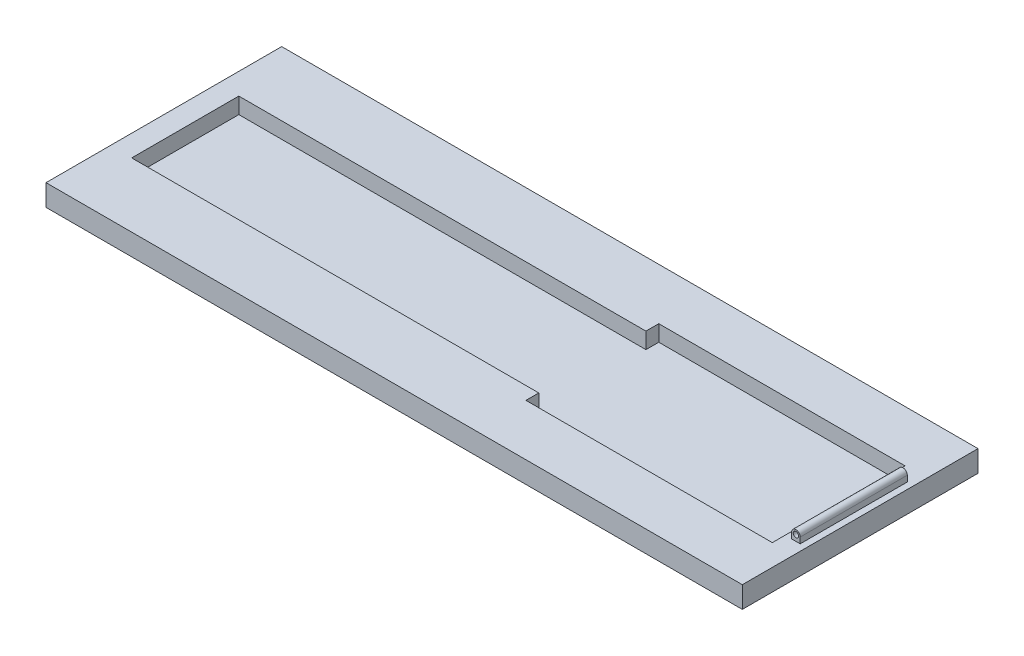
SolidWorks part; units mm, degrees
ref_plane "Face" through (0, 0, 0) normal (0, 0, 1) x (1, 0, 0)
ref_plane "Dessus" through (0, 0, 0) normal (0, 1, 0) x (1, 0, 0)
ref_plane "Droite" through (0, 0, 0) normal (1, 0, 0) x (0, 0, -1)
sketch "Esquisse1" plane through (0, 0, 0) normal (0, 0, 1) x (1, 0, 0)
  line L1 (-6400, -55) -> (100, -55)
  line L2 (-6400, -55) -> (-6400, -255)
  line L3 (-6400, -255) -> (100, -255)
  line L4 (100, -55) -> (100, -255)
  dimension "D1" = 6500
  dimension "D2" = 100
  dimension "D3" = 55
  dimension "D4" = 200
extrude "Extrusion1" add sketch "Esquisse1" along normal mid plane 2200
sketch "Esquisse2" plane through (0, 0, 0) normal (0, 0, 1) x (1, 0, 0)
  line L0 (-40, 0) -> (-40, -55)
  line L1 (100, -55) -> (-6400, -55) construction
  line L2 (-40, -55) -> (40, -55)
  line L3 (40, -55) -> (40, 0)
  circle A0 centre (0, 0) radius 25
  arc A1 (40, 0) -> (-40, 0) centre (0, 0) ccw
  dimension "D1" = 50
  dimension "D2" = 80
extrude "Extrusion2" add sketch "Esquisse2" along normal mid plane 1000
sketch "Esquisse3" plane through (0, -55, 0) normal (0, 1, 0) x (1, 0, 0)
  line L0 (100, -1100) -> (100, 1100) construction
  line L1 (-2400, 620) -> (-100, 620)
  line L2 (-2400, 620) -> (-2400, 500)
  line L3 (-2400, -620) -> (-100, -620)
  line L4 (-100, 620) -> (-100, -620)
  line L5 (100, 1100) -> (-6400, 1100) construction
  line L6 (100, -1100) -> (-6400, -1100) construction
  line L8 (-6400, -1100) -> (-6400, 1100) construction
  line L9 (-2400, 500) -> (-6200, 500)
  line L11 (-2400, -500) -> (-6200, -500)
  line L12 (-6200, 500) -> (-6200, -500)
  line L13 (-2400, -500) -> (-2400, -620)
  dimension "D1" = 200
  dimension "D2" = 480
  dimension "D3" = 480
  dimension "D4" = 2300
  dimension "D5" = 200
  dimension "D6" = 600
  dimension "D7" = 600
extrude "Enlèv. mat.-Extru.1" cut sketch "Esquisse3" against normal blind 150
sketch "Esquisse4" plane through (0, -255, 0) normal (0, -1, 0) x (1, 0, 0)
  line L0 (-6400, 1100) -> (100, 1100) construction
  line L1 (-6400, 1100) -> (-6400, -1100) construction
  point P0 (-3150, 0)
  point P3 (-6400, 0)
  dimension "D1" = 1100
  dimension "D2" = 3250
